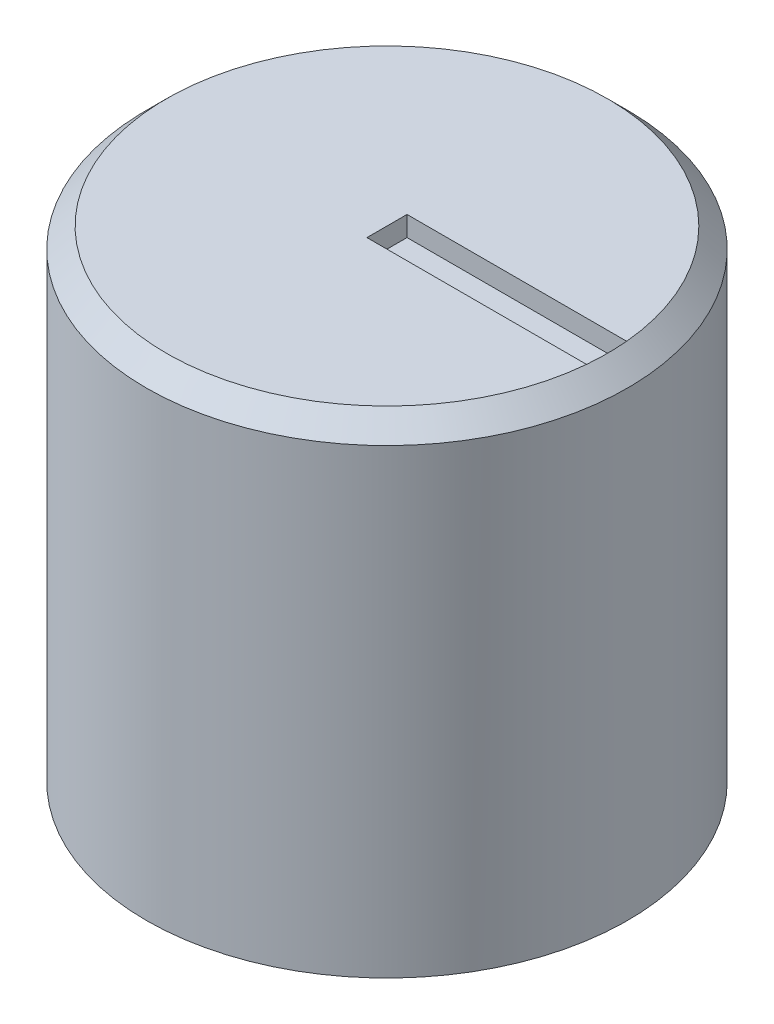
SolidWorks part; units mm, degrees
ref_plane "Alzado" through (0, 0, 0) normal (0, 0, 1) x (1, 0, 0)
ref_plane "Planta" through (0, 0, 0) normal (0, 1, 0) x (1, 0, 0)
ref_plane "Vista lateral" through (0, 0, 0) normal (1, 0, 0) x (0, 0, -1)
sketch "Croquis1" plane through (0, 0, 0) normal (0, 1, 0) x (1, 0, 0)
  circle A0 centre (0, 0) radius 6
  dimension "D1" = 12
extrude "Saliente-Extruir1" add sketch "Croquis1" along normal blind 12
sketch "Croquis2" plane through (0, 0, 0) normal (0, -1, 0) x (1, 0, 0)
  circle A0 centre (0, 0) radius 5.5
  dimension "D1" = 11
extrude "Cortar-Extruir1" cut sketch "Croquis2" against normal blind 10.5
sketch "Croquis3" plane through (0, 10.5, 0) normal (0, -1, 0) x (1, 0, 0)
  circle A0 centre (0, 0) radius 4
  circle A1 centre (0, 0) radius 3
  dimension "D1" = 6
  dimension "D2" = 8
extrude "Saliente-Extruir2" add sketch "Croquis3" along normal offset from surface (8 mm away) 2.5
chamfer "Chaflán1" distance 2 angle 60 1 edges at (0, 10.5, -5.5)
chamfer "Chaflán2" distance 0.5 angle 45 1 edges at (0, 12, 6)
sketch "Croquis4" plane through (0, 12, 0) normal (0, 1, 0) x (1, 0, 0)
  line L0 (0, -6.6) -> (0, 6.6) construction
  line L1 (0, 0.5) -> (5.4772, 0.5)
  line L2 (0, 0.5) -> (0, -0.5)
  line L3 (0, -0.5) -> (5.4772, -0.5)
  line L4 (-6.6, 0) -> (6.6, 0) construction
  circle A2 centre (0, 0) radius 5.5
  arc A3 (5.4772, -0.5) -> (5.4772, 0.5) centre (0, 0) ccw
  point P1 (0, 0)
  dimension "D1" = 1
  dimension "D2" = 0
extrude "Cortar-Extruir2" cut sketch "Croquis4" against normal blind 0.5
